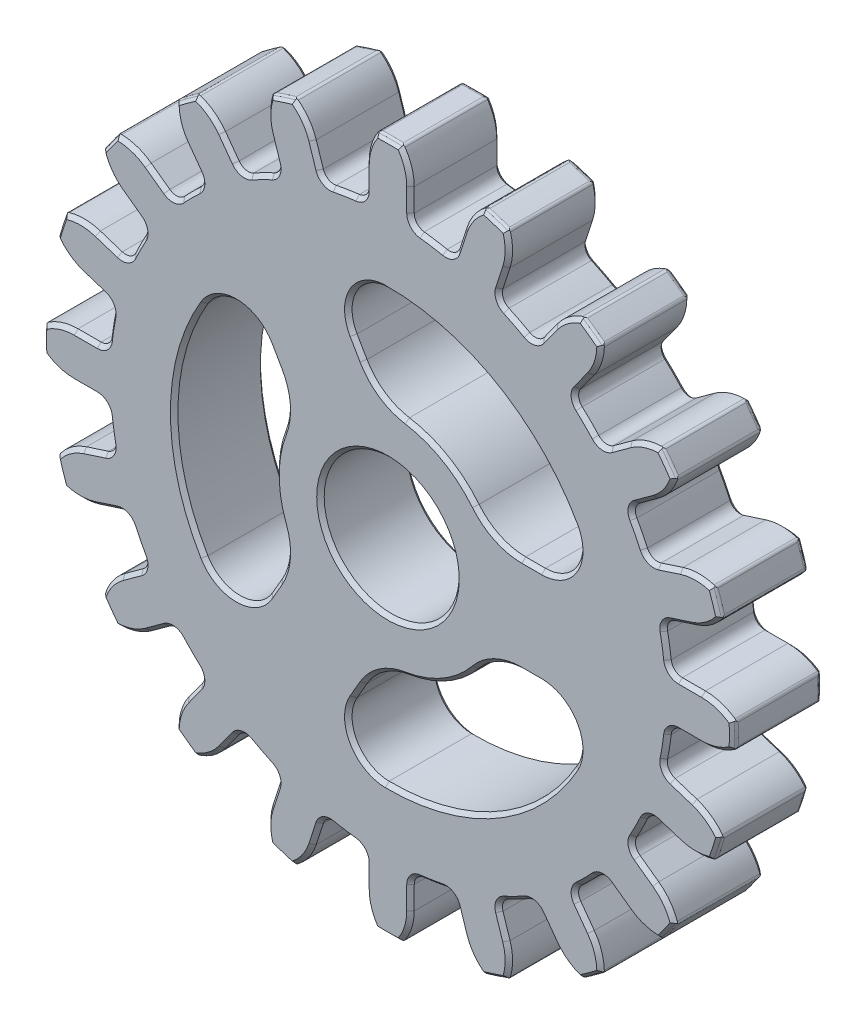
SolidWorks part; units mm, degrees
ref_plane "Спереди" through (0, 0, 0) normal (0, 0, 1) x (1, 0, 0)
ref_plane "Сверху" through (0, 0, 0) normal (0, 1, 0) x (1, 0, 0)
ref_plane "Справа" through (0, 0, 0) normal (1, 0, 0) x (0, 0, -1)
sketch "Эскиз1" plane through (0, 0, 0) normal (0, 0, 1) x (1, 0, 0)
  line L0 (0, 0) -> (0, 23) construction
  line L1 (0, 0) -> (23, 0) construction
  line L2 (8.9268, 3.25) -> (10.247, 3.25)
  line L3 (8.9268, -3.25) -> (10.247, -3.25)
  line L4 (-1.6488, -9.3558) -> (-2.3089, -10.4991)
  line L5 (-7.278, -6.1058) -> (-7.9381, -7.2491)
  line L6 (-7.278, 6.1058) -> (-7.9381, 7.2491)
  line L7 (-1.6488, 9.3558) -> (-2.3089, 10.4991)
  line L8 (-1.5, 20.9045) -> (-1.5, 19.3698)
  line L9 (1.5, 20.9045) -> (1.5, 19.3698)
  line L10 (5.0333, 20.3449) -> (4.559, 18.8853)
  line L11 (7.8864, 19.4179) -> (7.4122, 17.9582)
  line L12 (11.0739, 17.7938) -> (10.1717, 16.5521)
  line L13 (13.5009, 16.0305) -> (12.5988, 14.7888)
  line L14 (16.0305, 13.5009) -> (14.7888, 12.5988)
  line L15 (17.7938, 11.0739) -> (16.5521, 10.1717)
  line L16 (19.4179, 7.8864) -> (17.9582, 7.4122)
  line L17 (20.3449, 5.0333) -> (18.8853, 4.559)
  line L18 (20.9045, 1.5) -> (19.3698, 1.5)
  line L19 (20.9045, -1.5) -> (19.3698, -1.5)
  line L20 (20.3449, -5.0333) -> (18.8853, -4.559)
  line L21 (19.4179, -7.8864) -> (17.9582, -7.4122)
  line L22 (17.7938, -11.0739) -> (16.5521, -10.1717)
  line L23 (16.0305, -13.5009) -> (14.7888, -12.5988)
  line L24 (13.5009, -16.0305) -> (12.5988, -14.7888)
  line L25 (11.0739, -17.7938) -> (10.1717, -16.5521)
  line L26 (7.8864, -19.4179) -> (7.4122, -17.9582)
  line L27 (5.0333, -20.3449) -> (4.559, -18.8853)
  line L28 (1.5, -20.9045) -> (1.5, -19.3698)
  line L29 (-1.5, -20.9045) -> (-1.5, -19.3698)
  line L30 (-5.0333, -20.3449) -> (-4.559, -18.8853)
  line L31 (-7.8864, -19.4179) -> (-7.4122, -17.9582)
  line L32 (-11.0739, -17.7938) -> (-10.1717, -16.5521)
  line L33 (-13.5009, -16.0305) -> (-12.5988, -14.7888)
  line L34 (-16.0305, -13.5009) -> (-14.7888, -12.5988)
  line L35 (-17.7938, -11.0739) -> (-16.5521, -10.1717)
  line L36 (-19.4179, -7.8864) -> (-17.9582, -7.4122)
  line L37 (-20.3449, -5.0333) -> (-18.8853, -4.559)
  line L38 (-20.9045, -1.5) -> (-19.3698, -1.5)
  line L39 (-20.9045, 1.5) -> (-19.3698, 1.5)
  line L40 (-20.3449, 5.0333) -> (-18.8853, 4.559)
  line L41 (-19.4179, 7.8864) -> (-17.9582, 7.4122)
  line L42 (-17.7938, 11.0739) -> (-16.5521, 10.1717)
  line L43 (-16.0305, 13.5009) -> (-14.7888, 12.5988)
  line L44 (-13.5009, 16.0305) -> (-12.5988, 14.7888)
  line L45 (-11.0739, 17.7938) -> (-10.1717, 16.5521)
  line L46 (-7.8864, 19.4179) -> (-7.4122, 17.9582)
  line L47 (-5.0333, 20.3449) -> (-4.559, 18.8853)
  arc A0 (0.8141, 22.9856) -> (-0.8141, 22.9856) centre (0, 0) ccw
  arc A1 (-7.8129, 17.0447) -> (-9.1971, 16.3394) centre (0, 0) ccw
  circle A2 centre (0, 0) radius 21 construction
  arc A3 (12.4272, 6.9734) -> (-0.1744, 14.2489) centre (0, 0) ccw
  arc A4 (5.8218, 4.7283) -> (1.1839, 7.406) centre (0, 0) ccw
  circle A5 centre (0, 0) radius 4.5
  arc A6 (-12.2527, 7.2755) -> (-12.2527, -7.2755) centre (0, 0) ccw
  arc A7 (-7.0057, 2.6777) -> (-7.0057, -2.6777) centre (0, 0) ccw
  arc A8 (1.1839, -7.406) -> (5.8218, -4.7283) centre (0, 0) ccw
  arc A9 (-0.1744, -14.2489) -> (12.4272, -6.9734) centre (0, 0) ccw
  arc A10 (10.247, 3.25) -> (12.4272, 6.9734) centre (10.247, 5.75) ccw
  arc A11 (10.247, -3.25) -> (12.4272, -6.9734) centre (10.247, -5.75) cw
  arc A12 (-2.3089, -10.4991) -> (-0.1744, -14.2489) centre (-0.1438, -11.7491) ccw
  arc A13 (-7.9381, -7.2491) -> (-12.2527, -7.2755) centre (-10.1031, -5.9991) cw
  arc A14 (-7.9381, 7.2491) -> (-12.2527, 7.2755) centre (-10.1031, 5.9991) ccw
  arc A15 (-2.3089, 10.4991) -> (-0.1744, 14.2489) centre (-0.1438, 11.7491) cw
  arc A16 (-7.278, -6.1058) -> (-7.0057, -2.6777) centre (-10.7421, -4.1058) ccw
  arc A17 (-1.6488, -9.3558) -> (1.1839, -7.406) centre (1.8153, -11.3558) cw
  arc A18 (8.9268, -3.25) -> (5.8218, -4.7283) centre (8.9268, -7.25) ccw
  arc A19 (8.9268, 3.25) -> (5.8218, 4.7283) centre (8.9268, 7.25) cw
  arc A20 (-1.6488, 9.3558) -> (1.1839, 7.406) centre (1.8153, 11.3558) ccw
  arc A21 (-7.278, 6.1058) -> (-7.0057, 2.6777) centre (-10.7421, 4.1058) cw
  arc A22 (-0.8141, 22.9856) -> (-1.5, 20.9045) centre (2, 20.9045) ccw
  arc A23 (0.8141, 22.9856) -> (1.5, 20.9045) centre (-2, 20.9045) cw
  arc A24 (6.3287, 22.1122) -> (5.0333, 20.3449) centre (8.362, 19.2634) ccw
  arc A25 (7.8772, 21.609) -> (6.3287, 22.1122) centre (0, 0) ccw
  arc A26 (7.8772, 21.609) -> (7.8864, 19.4179) centre (4.5577, 20.4994) cw
  arc A27 (12.852, 19.0743) -> (11.0739, 17.7938) centre (13.9054, 15.7366) ccw
  arc A28 (14.1692, 18.1172) -> (12.852, 19.0743) centre (0, 0) ccw
  arc A29 (14.1692, 18.1172) -> (13.5009, 16.0305) centre (10.6693, 18.0877) cw
  arc A30 (18.1172, 14.1692) -> (16.0305, 13.5009) centre (18.0877, 10.6693) ccw
  arc A31 (19.0743, 12.852) -> (18.1172, 14.1692) centre (0, 0) ccw
  arc A32 (19.0743, 12.852) -> (17.7938, 11.0739) centre (15.7366, 13.9054) cw
  arc A33 (21.609, 7.8772) -> (19.4179, 7.8864) centre (20.4994, 4.5577) ccw
  arc A34 (22.1122, 6.3287) -> (21.609, 7.8772) centre (0, 0) ccw
  arc A35 (22.1122, 6.3287) -> (20.3449, 5.0333) centre (19.2634, 8.362) cw
  arc A36 (22.9856, 0.8141) -> (20.9045, 1.5) centre (20.9045, -2) ccw
  arc A37 (22.9856, -0.8141) -> (22.9856, 0.8141) centre (0, 0) ccw
  arc A38 (22.9856, -0.8141) -> (20.9045, -1.5) centre (20.9045, 2) cw
  arc A39 (22.1122, -6.3287) -> (20.3449, -5.0333) centre (19.2634, -8.362) ccw
  arc A40 (21.609, -7.8772) -> (22.1122, -6.3287) centre (0, 0) ccw
  arc A41 (21.609, -7.8772) -> (19.4179, -7.8864) centre (20.4994, -4.5577) cw
  arc A42 (19.0743, -12.852) -> (17.7938, -11.0739) centre (15.7366, -13.9054) ccw
  arc A43 (18.1172, -14.1692) -> (19.0743, -12.852) centre (0, 0) ccw
  arc A44 (18.1172, -14.1692) -> (16.0305, -13.5009) centre (18.0877, -10.6693) cw
  arc A45 (14.1692, -18.1172) -> (13.5009, -16.0305) centre (10.6693, -18.0877) ccw
  arc A46 (12.852, -19.0743) -> (14.1692, -18.1172) centre (0, 0) ccw
  arc A47 (12.852, -19.0743) -> (11.0739, -17.7938) centre (13.9054, -15.7366) cw
  arc A48 (7.8772, -21.609) -> (7.8864, -19.4179) centre (4.5577, -20.4994) ccw
  arc A49 (6.3287, -22.1122) -> (7.8772, -21.609) centre (0, 0) ccw
  arc A50 (6.3287, -22.1122) -> (5.0333, -20.3449) centre (8.362, -19.2634) cw
  arc A51 (0.8141, -22.9856) -> (1.5, -20.9045) centre (-2, -20.9045) ccw
  arc A52 (-0.8141, -22.9856) -> (0.8141, -22.9856) centre (0, 0) ccw
  arc A53 (-0.8141, -22.9856) -> (-1.5, -20.9045) centre (2, -20.9045) cw
  arc A54 (-6.3287, -22.1122) -> (-5.0333, -20.3449) centre (-8.362, -19.2634) ccw
  arc A55 (-7.8772, -21.609) -> (-6.3287, -22.1122) centre (0, 0) ccw
  arc A56 (-7.8772, -21.609) -> (-7.8864, -19.4179) centre (-4.5577, -20.4994) cw
  arc A57 (-12.852, -19.0743) -> (-11.0739, -17.7938) centre (-13.9054, -15.7366) ccw
  arc A58 (-14.1692, -18.1172) -> (-12.852, -19.0743) centre (0, 0) ccw
  arc A59 (-14.1692, -18.1172) -> (-13.5009, -16.0305) centre (-10.6693, -18.0877) cw
  arc A60 (-18.1172, -14.1692) -> (-16.0305, -13.5009) centre (-18.0877, -10.6693) ccw
  arc A61 (-19.0743, -12.852) -> (-18.1172, -14.1692) centre (0, 0) ccw
  arc A62 (-19.0743, -12.852) -> (-17.7938, -11.0739) centre (-15.7366, -13.9054) cw
  arc A63 (-21.609, -7.8772) -> (-19.4179, -7.8864) centre (-20.4994, -4.5577) ccw
  arc A64 (-22.1122, -6.3287) -> (-21.609, -7.8772) centre (0, 0) ccw
  arc A65 (-22.1122, -6.3287) -> (-20.3449, -5.0333) centre (-19.2634, -8.362) cw
  arc A66 (-22.9856, -0.8141) -> (-20.9045, -1.5) centre (-20.9045, 2) ccw
  arc A67 (-22.9856, 0.8141) -> (-22.9856, -0.8141) centre (0, 0) ccw
  arc A68 (-22.9856, 0.8141) -> (-20.9045, 1.5) centre (-20.9045, -2) cw
  arc A69 (-22.1122, 6.3287) -> (-20.3449, 5.0333) centre (-19.2634, 8.362) ccw
  arc A70 (-21.609, 7.8772) -> (-22.1122, 6.3287) centre (0, 0) ccw
  arc A71 (-21.609, 7.8772) -> (-19.4179, 7.8864) centre (-20.4994, 4.5577) cw
  arc A72 (-19.0743, 12.852) -> (-17.7938, 11.0739) centre (-15.7366, 13.9054) ccw
  arc A73 (-18.1172, 14.1692) -> (-19.0743, 12.852) centre (0, 0) ccw
  arc A74 (-18.1172, 14.1692) -> (-16.0305, 13.5009) centre (-18.0877, 10.6693) cw
  arc A75 (-14.1692, 18.1172) -> (-13.5009, 16.0305) centre (-10.6693, 18.0877) ccw
  arc A76 (-12.852, 19.0743) -> (-14.1692, 18.1172) centre (0, 0) ccw
  arc A77 (-12.852, 19.0743) -> (-11.0739, 17.7938) centre (-13.9054, 15.7366) cw
  arc A78 (-7.8772, 21.609) -> (-7.8864, 19.4179) centre (-4.5577, 20.4994) ccw
  arc A79 (-6.3287, 22.1122) -> (-7.8772, 21.609) centre (0, 0) ccw
  arc A80 (-6.3287, 22.1122) -> (-5.0333, 20.3449) centre (-8.362, 19.2634) cw
  arc A81 (-12.6976, 13.7961) -> (-13.7961, 12.6976) centre (0, 0) ccw
  arc A82 (-2.1635, 18.6248) -> (-3.6978, 18.3818) centre (0, 0) ccw
  arc A83 (3.6978, 18.3818) -> (2.1635, 18.6248) centre (0, 0) ccw
  arc A84 (9.1971, 16.3394) -> (7.8129, 17.0447) centre (0, 0) ccw
  arc A85 (13.7961, 12.6976) -> (12.6976, 13.7961) centre (0, 0) ccw
  arc A86 (17.0447, 7.8129) -> (16.3394, 9.1971) centre (0, 0) ccw
  arc A87 (-16.3394, 9.1971) -> (-17.0447, 7.8129) centre (0, 0) ccw
  arc A88 (-18.3818, 3.6978) -> (-18.6248, 2.1635) centre (0, 0) ccw
  arc A89 (-18.6248, -2.1635) -> (-18.3818, -3.6978) centre (0, 0) ccw
  arc A90 (-17.0447, -7.8129) -> (-16.3394, -9.1971) centre (0, 0) ccw
  arc A91 (-13.7961, -12.6976) -> (-12.6976, -13.7961) centre (0, 0) ccw
  arc A92 (-9.1971, -16.3394) -> (-7.8129, -17.0447) centre (0, 0) ccw
  arc A93 (-3.6978, -18.3818) -> (-2.1635, -18.6248) centre (0, 0) ccw
  arc A94 (2.1635, -18.6248) -> (3.6978, -18.3818) centre (0, 0) ccw
  arc A95 (7.8129, -17.0447) -> (9.1971, -16.3394) centre (0, 0) ccw
  arc A96 (12.6976, -13.7961) -> (13.7961, -12.6976) centre (0, 0) ccw
  arc A97 (16.3394, -9.1971) -> (17.0447, -7.8129) centre (0, 0) ccw
  arc A98 (18.3818, -3.6978) -> (18.6248, -2.1635) centre (0, 0) ccw
  arc A99 (18.6248, 2.1635) -> (18.3818, 3.6978) centre (0, 0) ccw
  arc A100 (14.7888, -12.5988) -> (13.7961, -12.6976) centre (14.3479, -13.2055) ccw
  arc A101 (12.5988, -14.7888) -> (12.6976, -13.7961) centre (13.2055, -14.3479) cw
  arc A102 (10.1717, -16.5521) -> (9.1971, -16.3394) centre (9.565, -16.993) ccw
  arc A103 (7.4122, -17.9582) -> (7.8129, -17.0447) centre (8.1255, -17.7264) cw
  arc A104 (4.559, -18.8853) -> (3.6978, -18.3818) centre (3.8457, -19.117) ccw
  arc A105 (1.5, -19.3698) -> (2.1635, -18.6248) centre (2.25, -19.3698) cw
  arc A106 (-1.5, -19.3698) -> (-2.1635, -18.6248) centre (-2.25, -19.3698) ccw
  arc A107 (-4.559, -18.8853) -> (-3.6978, -18.3818) centre (-3.8457, -19.117) cw
  arc A108 (-7.4122, -17.9582) -> (-7.8129, -17.0447) centre (-8.1255, -17.7264) ccw
  arc A109 (-10.1717, -16.5521) -> (-9.1971, -16.3394) centre (-9.565, -16.993) cw
  arc A110 (-12.5988, -14.7888) -> (-12.6976, -13.7961) centre (-13.2055, -14.3479) ccw
  arc A111 (-14.7888, -12.5988) -> (-13.7961, -12.6976) centre (-14.3479, -13.2055) cw
  arc A112 (-16.5521, -10.1717) -> (-16.3394, -9.1971) centre (-16.993, -9.565) ccw
  arc A113 (-17.9582, -7.4122) -> (-17.0447, -7.8129) centre (-17.7264, -8.1255) cw
  arc A114 (-18.8853, -4.559) -> (-18.3818, -3.6978) centre (-19.117, -3.8457) ccw
  arc A115 (-19.3698, -1.5) -> (-18.6248, -2.1635) centre (-19.3698, -2.25) cw
  arc A116 (-19.3698, 1.5) -> (-18.6248, 2.1635) centre (-19.3698, 2.25) ccw
  arc A117 (-18.8853, 4.559) -> (-18.3818, 3.6978) centre (-19.117, 3.8457) cw
  arc A118 (-17.9582, 7.4122) -> (-17.0447, 7.8129) centre (-17.7264, 8.1255) ccw
  arc A119 (-16.5521, 10.1717) -> (-16.3394, 9.1971) centre (-16.993, 9.565) cw
  arc A120 (-12.5988, 14.7888) -> (-12.6976, 13.7961) centre (-13.2055, 14.3479) cw
  arc A121 (-14.7888, 12.5988) -> (-13.7961, 12.6976) centre (-14.3479, 13.2055) ccw
  arc A122 (16.5521, -10.1717) -> (16.3394, -9.1971) centre (16.993, -9.565) cw
  arc A123 (17.9582, -7.4122) -> (17.0447, -7.8129) centre (17.7264, -8.1255) ccw
  arc A124 (18.8853, -4.559) -> (18.3818, -3.6978) centre (19.117, -3.8457) cw
  arc A125 (19.3698, -1.5) -> (18.6248, -2.1635) centre (19.3698, -2.25) ccw
  arc A126 (19.3698, 1.5) -> (18.6248, 2.1635) centre (19.3698, 2.25) cw
  arc A127 (18.8853, 4.559) -> (18.3818, 3.6978) centre (19.117, 3.8457) ccw
  arc A128 (17.9582, 7.4122) -> (17.0447, 7.8129) centre (17.7264, 8.1255) cw
  arc A129 (16.5521, 10.1717) -> (16.3394, 9.1971) centre (16.993, 9.565) ccw
  arc A130 (14.7888, 12.5988) -> (13.7961, 12.6976) centre (14.3479, 13.2055) cw
  arc A131 (12.5988, 14.7888) -> (12.6976, 13.7961) centre (13.2055, 14.3479) ccw
  arc A132 (7.4122, 17.9582) -> (7.8129, 17.0447) centre (8.1255, 17.7264) ccw
  arc A133 (10.1717, 16.5521) -> (9.1971, 16.3394) centre (9.565, 16.993) cw
  arc A134 (4.559, 18.8853) -> (3.6978, 18.3818) centre (3.8457, 19.117) cw
  arc A135 (1.5, 19.3698) -> (2.1635, 18.6248) centre (2.25, 19.3698) ccw
  arc A136 (-1.5, 19.3698) -> (-2.1635, 18.6248) centre (-2.25, 19.3698) cw
  arc A137 (-4.559, 18.8853) -> (-3.6978, 18.3818) centre (-3.8457, 19.117) ccw
  arc A138 (-7.4122, 17.9582) -> (-7.8129, 17.0447) centre (-8.1255, 17.7264) cw
  arc A139 (-10.1717, 16.5521) -> (-9.1971, 16.3394) centre (-9.565, 16.993) ccw
  point P14 (13.8744, 3.25)
  point P25 (13.8744, -3.25)
  point P40 (6.7593, -3.25)
  point P43 (6.7593, 3.25)
  point P297 (1.5, 18.6899)
  point P300 (-1.5, 18.6899)
  dimension "D1" = 46
  dimension "D2" = 9
  dimension "D3" = 42
  dimension "D4" = 37.5
  dimension "D5" = 15
  dimension "D6" = 28.5
  dimension "D9" = 2.5
  dimension "D10" = 4
  dimension "D11" = 7
  dimension "D14" = 0.75
  dimension "D7" = 6.5
  dimension "D12" = 3
  dimension "D8" = 3
  dimension "D13" = 20
extrude "Бобышка-Вытянуть1" add sketch "Эскиз1" along normal blind 6
chamfer "Фаска1" distance 0.25 angle 45 370 edges at (-10.0878, 8.4991, 0) (-7.608, 6.6775, 0) (-6.7546, 4.4225, 0) (-7.5, 0, 0) (-6.7546, -4.4225, 0) (-7.608, -6.6775, 0) (-10.0878, -8.4991, 0) (-14.25, 0, 0) (4.5, 0, 0) (0, 23, 0) (-1.3241, 22.0001, 0) (-1.5, 20.1372, 0) (-1.6899, 18.871, 0) (-2.9331, 18.5192, 0) (-4.2242, 18.4696, 0) (-4.7961, 19.6151, 0) (-5.5391, 21.3325, 0) (-7.1074, 21.8743, 0) (-8.0577, 20.5142, 0) (-7.6493, 18.688, 0) (-7.4386, 17.4251, 0) (-8.5123, 16.7064, 0) (-9.7249, 16.2602, 0) (-10.6228, 17.173, 0) (-11.8601, 18.5768, 0) (-13.5191, 18.6074, 0) (-14.0026, 17.0202, 0) (-13.0498, 15.4096, 0) (-12.4592, 14.2736, 0) (-13.2583, 13.2583, 0) (-14.2736, 12.4592, 0) (-15.4096, 13.0498, 0) (-17.0202, 14.0026, 0) (-18.6074, 13.5191, 0) (-18.5768, 11.8601, 0) (-17.173, 10.6228, 0) (-16.2602, 9.7249, 0) (-16.7064, 8.5123, 0) (-17.4251, 7.4386, 0) (-18.688, 7.6493, 0) (-20.5142, 8.0577, 0) (-21.8743, 7.1074, 0) (-21.3325, 5.5391, 0) (-19.6151, 4.7961, 0) (-18.4696, 4.2242, 0) (-18.5192, 2.9331, 0) (-18.871, 1.6899, 0) (-20.1372, 1.5, 0) (-22.0001, 1.3241, 0) (-23, 0, 0) (-22.0001, -1.3241, 0) (-20.1372, -1.5, 0) (-18.871, -1.6899, 0) (-18.5192, -2.9331, 0) (-18.4696, -4.2242, 0) (-19.6151, -4.7961, 0) (-21.3325, -5.5391, 0) (-21.8743, -7.1074, 0) (-20.5142, -8.0577, 0) (-18.688, -7.6493, 0) (-17.4251, -7.4386, 0) (-16.7064, -8.5123, 0) (-16.2602, -9.7249, 0) (-17.173, -10.6228, 0) (-18.5768, -11.8601, 0) (-18.6074, -13.5191, 0) (-17.0202, -14.0026, 0) (-15.4096, -13.0498, 0) (-14.2736, -12.4592, 0) (-13.2583, -13.2583, 0) (-12.4592, -14.2736, 0) (-13.0498, -15.4096, 0) (-14.0026, -17.0202, 0) (-13.5191, -18.6074, 0) (-11.8601, -18.5768, 0) (-10.6228, -17.173, 0) (-9.7249, -16.2602, 0) (-8.5123, -16.7064, 0) (-7.4386, -17.4251, 0) (-7.6493, -18.688, 0) (-8.0577, -20.5142, 0) (-7.1074, -21.8743, 0) (-5.5391, -21.3325, 0) (-4.7961, -19.6151, 0) (-4.2242, -18.4696, 0) (-2.9331, -18.5192, 0) (-1.6899, -18.871, 0) (-1.5, -20.1372, 0) (-1.3241, -22.0001, 0) (0, -23, 0) (1.3241, -22.0001, 0) (1.5, -20.1372, 0) (1.6899, -18.871, 0) (2.9331, -18.5192, 0) (4.2242, -18.4696, 0) (4.7961, -19.6151, 0) (5.5391, -21.3325, 0) (7.1074, -21.8743, 0) (8.0577, -20.5142, 0) (7.6493, -18.688, 0) (7.4386, -17.4251, 0) (8.5123, -16.7064, 0) (9.7249, -16.2602, 0) (10.6228, -17.173, 0) (11.8601, -18.5768, 0) (13.5191, -18.6074, 0) (14.0026, -17.0202, 0) (13.0498, -15.4096, 0) (12.4592, -14.2736, 0) (13.2583, -13.2583, 0) (14.2736, -12.4592, 0) (15.4096, -13.0498, 0) (17.0202, -14.0026, 0) (18.6074, -13.5191, 0) (18.5768, -11.8601, 0) (17.173, -10.6228, 0) (16.2602, -9.7249, 0) (16.7064, -8.5123, 0) (17.4251, -7.4386, 0) (18.688, -7.6493, 0) (20.5142, -8.0577, 0) (21.8743, -7.1074, 0) (21.3325, -5.5391, 0) (19.6151, -4.7961, 0) (18.4696, -4.2242, 0) (18.5192, -2.9331, 0) (18.871, -1.6899, 0) (20.1372, -1.5, 0) (22.0001, -1.3241, 0) (23, 0, 0) (22.0001, 1.3241, 0) (20.1372, 1.5, 0) (18.871, 1.6899, 0) (18.5192, 2.9331, 0) (18.4696, 4.2242, 0) (19.6151, 4.7961, 0) (21.3325, 5.5391, 0) (21.8743, 7.1074, 0) (20.5142, 8.0577, 0) (18.688, 7.6493, 0) (17.4251, 7.4386, 0) (16.7064, 8.5123, 0) (16.2602, 9.7249, 0) (17.173, 10.6228, 0) (18.5768, 11.8601, 0) (18.6074, 13.5191, 0) (17.0202, 14.0026, 0) (15.4096, 13.0498, 0) (14.2736, 12.4592, 0) (13.2583, 13.2583, 0) (12.4592, 14.2736, 0) (13.0498, 15.4096, 0) (14.0026, 17.0202, 0) (13.5191, 18.6074, 0) (11.8601, 18.5768, 0) (10.6228, 17.173, 0) (9.7249, 16.2602, 0) (8.5123, 16.7064, 0) (7.4386, 17.4251, 0) (7.6493, 18.688, 0) (8.0577, 20.5142, 0) (7.1074, 21.8743, 0) (5.5391, 21.3325, 0) (4.7961, 19.6151, 0) (4.2242, 18.4696, 0) (2.9331, 18.5192, 0) (1.6899, 18.871, 0) (1.5, 20.1372, 0) (1.3241, 22.0001, 0) (7.2073, 3.6384, 0) (3.75, 6.4952, 0) (-0.4527, 8.0609, 0) (-1.9789, 9.9275, 0) (-2.3165, 12.9858, 0) (7.125, 12.3409, 0) (12.4043, 4.4868, 0) (9.5869, 3.25, 0) (-2.3165, -12.9858, 0) (-1.9789, -9.9275, 0) (-0.4527, -8.0609, 0) (3.75, -6.4952, 0) (7.2073, -3.6384, 0) (9.5869, -3.25, 0) (12.4043, -4.4868, 0) (7.125, -12.3409, 0) (-7.608, -6.6775, 6) (-6.7546, -4.4225, 6) (-7.5, 0, 6) (-6.7546, 4.4225, 6) (-7.608, 6.6775, 6) (-10.0878, 8.4991, 6) (-14.25, 0, 6) (-10.0878, -8.4991, 6) (4.5, 0, 6) (1.5, 20.1372, 6) (1.6899, 18.871, 6) (2.9331, 18.5192, 6) (4.2242, 18.4696, 6) (4.7961, 19.6151, 6) (5.5391, 21.3325, 6) (7.1074, 21.8743, 6) (8.0577, 20.5142, 6) (7.6493, 18.688, 6) (7.4386, 17.4251, 6) (8.5123, 16.7064, 6) (9.7249, 16.2602, 6) (10.6228, 17.173, 6) (11.8601, 18.5768, 6) (13.5191, 18.6074, 6) (14.0026, 17.0202, 6) (13.0498, 15.4096, 6) (12.4592, 14.2736, 6) (13.2583, 13.2583, 6) (14.2736, 12.4592, 6) (15.4096, 13.0498, 6) (17.0202, 14.0026, 6) (18.6074, 13.5191, 6) (18.5768, 11.8601, 6) (17.173, 10.6228, 6) (16.2602, 9.7249, 6) (16.7064, 8.5123, 6) (17.4251, 7.4386, 6) (18.688, 7.6493, 6) (20.5142, 8.0577, 6) (21.8743, 7.1074, 6) (21.3325, 5.5391, 6) (19.6151, 4.7961, 6) (18.4696, 4.2242, 6) (18.5192, 2.9331, 6) (18.871, 1.6899, 6) (20.1372, 1.5, 6) (22.0001, 1.3241, 6) (23, 0, 6) (22.0001, -1.3241, 6) (20.1372, -1.5, 6) (18.871, -1.6899, 6) (18.5192, -2.9331, 6) (18.4696, -4.2242, 6) (19.6151, -4.7961, 6) (21.3325, -5.5391, 6) (21.8743, -7.1074, 6) (20.5142, -8.0577, 6) (18.688, -7.6493, 6) (17.4251, -7.4386, 6) (16.7064, -8.5123, 6) (16.2602, -9.7249, 6) (17.173, -10.6228, 6) (18.5768, -11.8601, 6) (18.6074, -13.5191, 6) (17.0202, -14.0026, 6) (15.4096, -13.0498, 6) (14.2736, -12.4592, 6) (13.2583, -13.2583, 6) (12.4592, -14.2736, 6) (13.0498, -15.4096, 6) (14.0026, -17.0202, 6) (13.5191, -18.6074, 6) (11.8601, -18.5768, 6) (10.6228, -17.173, 6) (9.7249, -16.2602, 6) (8.5123, -16.7064, 6) (7.4386, -17.4251, 6) (7.6493, -18.688, 6) (8.0577, -20.5142, 6) (7.1074, -21.8743, 6) (5.5391, -21.3325, 6) (4.7961, -19.6151, 6) (4.2242, -18.4696, 6) (2.9331, -18.5192, 6) (1.6899, -18.871, 6) (1.5, -20.1372, 6) (1.3241, -22.0001, 6) (0, -23, 6) (-1.3241, -22.0001, 6) (-1.5, -20.1372, 6) (-1.6899, -18.871, 6) (-2.9331, -18.5192, 6) (-4.2242, -18.4696, 6) (-4.7961, -19.6151, 6) (-5.5391, -21.3325, 6) (-7.1074, -21.8743, 6) (-8.0577, -20.5142, 6) (-7.6493, -18.688, 6) (-7.4386, -17.4251, 6) (-8.5123, -16.7064, 6) (-9.7249, -16.2602, 6) (-10.6228, -17.173, 6) (-11.8601, -18.5768, 6) (-13.5191, -18.6074, 6) (-14.0026, -17.0202, 6) (-13.0498, -15.4096, 6) (-12.4592, -14.2736, 6) (-13.2583, -13.2583, 6) (-14.2736, -12.4592, 6) (-15.4096, -13.0498, 6) (-17.0202, -14.0026, 6) (-18.6074, -13.5191, 6) (-18.5768, -11.8601, 6) (-17.173, -10.6228, 6) (-16.2602, -9.7249, 6) (-16.7064, -8.5123, 6) (-17.4251, -7.4386, 6) (-18.688, -7.6493, 6) (-20.5142, -8.0577, 6) (-21.8743, -7.1074, 6) (-21.3325, -5.5391, 6) (-19.6151, -4.7961, 6) (-18.4696, -4.2242, 6) (-18.5192, -2.9331, 6) (-18.871, -1.6899, 6) (-20.1372, -1.5, 6) (-22.0001, -1.3241, 6) (-23, 0, 6) (-22.0001, 1.3241, 6) (-20.1372, 1.5, 6) (-18.871, 1.6899, 6) (-18.5192, 2.9331, 6) (-18.4696, 4.2242, 6) (-19.6151, 4.7961, 6) (-21.3325, 5.5391, 6) (-21.8743, 7.1074, 6) (-20.5142, 8.0577, 6) (-18.688, 7.6493, 6) (-17.4251, 7.4386, 6) (-16.7064, 8.5123, 6) (-16.2602, 9.7249, 6) (-17.173, 10.6228, 6) (-18.5768, 11.8601, 6) (-18.6074, 13.5191, 6) (-17.0202, 14.0026, 6) (-15.4096, 13.0498, 6) (-14.2736, 12.4592, 6) (-13.2583, 13.2583, 6) (-12.4592, 14.2736, 6) (-13.0498, 15.4096, 6) (-14.0026, 17.0202, 6) (-13.5191, 18.6074, 6) (-11.8601, 18.5768, 6) (-10.6228, 17.173, 6) (-9.7249, 16.2602, 6) (-8.5123, 16.7064, 6) (-7.4386, 17.4251, 6) (-7.6493, 18.688, 6) (-8.0577, 20.5142, 6) (-7.1074, 21.8743, 6) (-5.5391, 21.3325, 6) (-4.7961, 19.6151, 6) (-4.2242, 18.4696, 6) (-2.9331, 18.5192, 6) (-1.6899, 18.871, 6) (-1.5, 20.1372, 6) (-1.3241, 22.0001, 6) (0, 23, 6) (1.3241, 22.0001, 6) (7.125, 12.3409, 6) (-2.3165, 12.9858, 6) (-1.9789, 9.9275, 6) (-0.4527, 8.0609, 6) (3.75, 6.4952, 6) (7.2073, 3.6384, 6) (9.5869, 3.25, 6) (12.4043, 4.4868, 6) (9.5869, -3.25, 6) (7.2073, -3.6384, 6) (3.75, -6.4952, 6) (-0.4527, -8.0609, 6) (-1.9789, -9.9275, 6) (-2.3165, -12.9858, 6) (7.125, -12.3409, 6) (12.4043, -4.4868, 6)
fillet "Скругление1" radius 0.25 80 edges at (-18.6074, 13.5191, 5.75) (-19.0743, 12.852, 3) (-18.6074, 13.5191, 0.25) (-18.1172, 14.1692, 3) (-21.8743, 7.1074, 5.75) (-22.1122, 6.3287, 3) (-21.8743, 7.1074, 0.25) (-21.609, 7.8772, 3) (-23, 0, 5.75) (-22.9856, -0.8141, 3) (-23, 0, 0.25) (-22.9856, 0.8141, 3) (-21.8743, -7.1074, 5.75) (-21.609, -7.8772, 3) (-21.8743, -7.1074, 0.25) (-22.1122, -6.3287, 3) (-18.6074, -13.5191, 5.75) (-18.1172, -14.1692, 3) (-18.6074, -13.5191, 0.25) (-19.0743, -12.852, 3) (-13.5191, -18.6074, 5.75) (-12.852, -19.0743, 3) (-13.5191, -18.6074, 0.25) (-14.1692, -18.1172, 3) (-7.1074, -21.8743, 5.75) (-6.3287, -22.1122, 3) (-7.1074, -21.8743, 0.25) (-7.8772, -21.609, 3) (0, -23, 5.75) (0.8141, -22.9856, 3) (0, -23, 0.25) (-0.8141, -22.9856, 3) (7.1074, -21.8743, 5.75) (7.8772, -21.609, 3) (7.1074, -21.8743, 0.25) (6.3287, -22.1122, 3) (13.5191, -18.6074, 5.75) (14.1692, -18.1172, 3) (13.5191, -18.6074, 0.25) (12.852, -19.0743, 3) (18.6074, -13.5191, 5.75) (19.0743, -12.852, 3) (18.6074, -13.5191, 0.25) (18.1172, -14.1692, 3) (21.8743, -7.1074, 5.75) (22.1122, -6.3287, 3) (21.8743, -7.1074, 0.25) (21.609, -7.8772, 3) (23, 0, 5.75) (22.9856, 0.8141, 3) (23, 0, 0.25) (22.9856, -0.8141, 3) (21.8743, 7.1074, 5.75) (21.609, 7.8772, 3) (21.8743, 7.1074, 0.25) (22.1122, 6.3287, 3) (18.6074, 13.5191, 5.75) (18.1172, 14.1692, 3) (18.6074, 13.5191, 0.25) (19.0743, 12.852, 3) (13.5191, 18.6074, 5.75) (12.852, 19.0743, 3) (13.5191, 18.6074, 0.25) (14.1692, 18.1172, 3) (7.1074, 21.8743, 5.75) (6.3287, 22.1122, 3) (7.1074, 21.8743, 0.25) (7.8772, 21.609, 3) (0, 23, 5.75) (-0.8141, 22.9856, 3) (0, 23, 0.25) (0.8141, 22.9856, 3) (-7.1074, 21.8743, 5.75) (-7.8772, 21.609, 3) (-7.1074, 21.8743, 0.25) (-6.3287, 22.1122, 3) (-13.5191, 18.6074, 5.75) (-14.1692, 18.1172, 3) (-13.5191, 18.6074, 0.25) (-12.852, 19.0743, 3)
